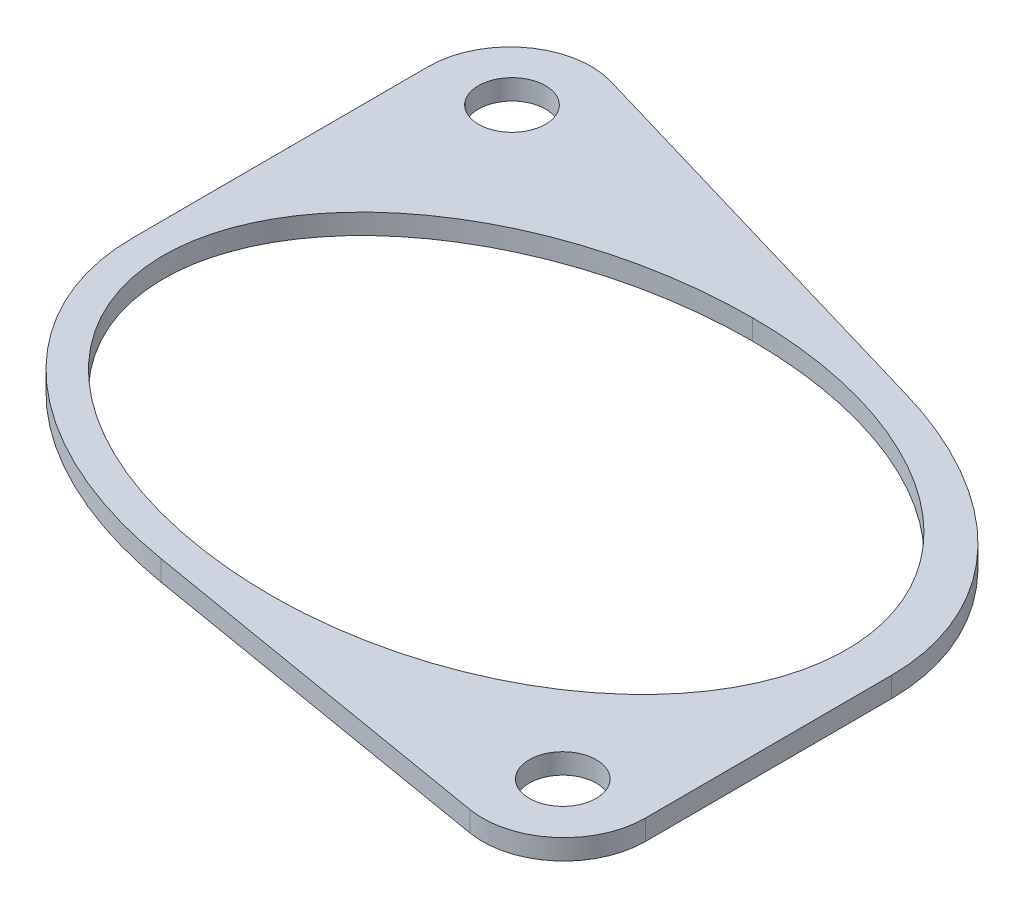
SolidWorks part; units mm, degrees
ref_plane "Front Plane" through (0, 0, 0) normal (0, 0, 1) x (1, 0, 0)
ref_plane "Top Plane" through (0, 0, 0) normal (0, 1, 0) x (1, 0, 0)
ref_plane "Right Plane" through (0, 0, 0) normal (1, 0, 0) x (0, 0, -1)
sketch "Sketch1" plane through (0, 0, 0) normal (0, 1, 0) x (1, 0, 0)
  line L0 (-18.17, 0) -> (-18.67, 0) construction
  line L1 (0, 13.35) -> (0, 12.85) construction
  line L2 (-18.17, 0) -> (-17.17, 0) construction
  line L3 (0, 12.85) -> (0, 11.85) construction
  line L4 (-18.7099, 19.9501) -> (-18.67, -0.0191)
  line L5 (-18.7099, 19.9501) -> (7.1116, 12.3436)
  line L6 (-15, 15) -> (-13.9545, 18.5492) construction
  line L7 (-15, 15) -> (-18.7, 14.9926) construction
  line L8 (18.67, 0.0229) -> (18.7105, -16.8795)
  line L9 (18.7105, -16.8795) -> (-4.2939, -12.9921)
  line L10 (15, -12.5) -> (18.7, -12.4911) construction
  line L11 (15, -12.5) -> (14.3835, -16.1483) construction
  circle A0 centre (15, -12.5) radius 1.65
  circle A1 centre (-15, 15) radius 1.65
  ellipse E0 centre (0, 0) end of major axis (-18.17, 0) minor radius 12.85 construction
  ellipse E1 centre (0, 0) end of major axis (-17.17, 0) minor radius 11.85 (0, 11.85) -> (0, -11.85) ccw
  ellipse E2 centre (0, 0) end of major axis (18.67, 0) minor radius 13.35 (-18.67, 0) -> (-4.2939, -12.9921) ccw
  ellipse E3 centre (0, 0) end of major axis (16.47, 0) minor radius 11.85 (0, 11.85) -> (0, -11.85) cw
  ellipse E4 centre (0, 0) end of major axis (18.67, 0) minor radius 13.35 (18.67, 0.0229) -> (0, 13.35) ccw
  dimension "D10" = 3.3
  dimension "D1" = 12.85
  dimension "D2" = 18.17
  dimension "D3" = 15
  dimension "D4" = 1
  dimension "D5" = 0.5
  dimension "D6" = 15
  dimension "D7" = 1.7
  dimension "D8" = 15
  dimension "D9" = 12.5
  dimension "D11" = 3.7
extrude "Boss-Extrude1" add sketch "Sketch1" along normal blind 1
fillet "Fillet1" radius 4 2 edges at (18.7105, 0.5, 16.8795) (-18.7099, 0.5, -19.9501)
